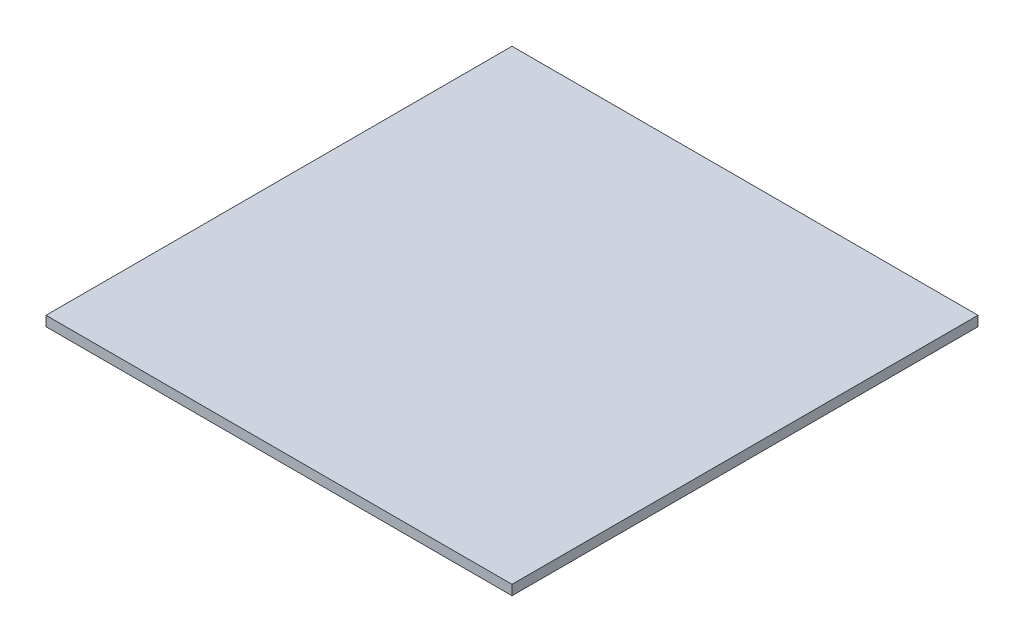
SolidWorks part; units mm, degrees
ref_plane "Alzado" through (0, 0, 0) normal (0, 0, 1) x (1, 0, 0)
ref_plane "Planta" through (0, 0, 0) normal (0, 1, 0) x (1, 0, 0)
ref_plane "Vista lateral" through (0, 0, 0) normal (1, 0, 0) x (0, 0, -1)
sketch "Sketch1" plane through (0, 0, 0) normal (0, 1, 0) x (1, 0, 0)
  line L1 (0, 0) -> (470, 0)
  line L2 (0, 0) -> (0, 470)
  line L3 (0, 470) -> (470, 470)
  line L4 (470, 0) -> (470, 470)
  dimension "D1" = 470
extrude "Boss-Extrude1" add sketch "Sketch1" along normal blind 10
